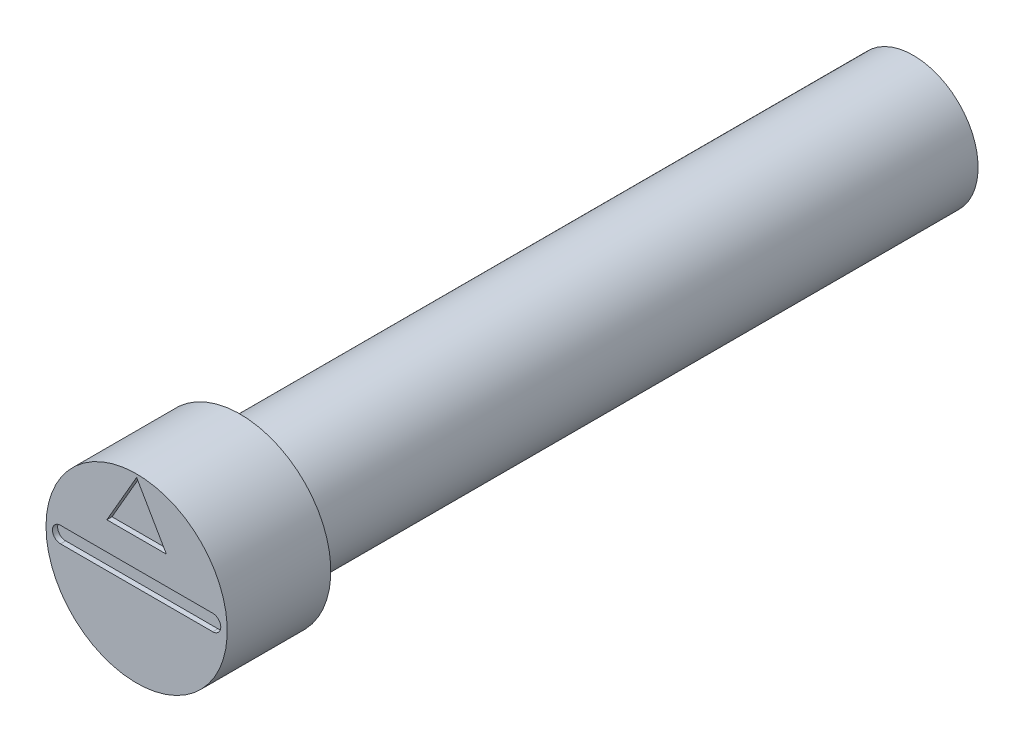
SolidWorks part; units mm, degrees
ref_plane "Front Plane" through (0, 0, 0) normal (0, 0, 1) x (1, 0, 0)
ref_plane "Top Plane" through (0, 0, 0) normal (0, 1, 0) x (1, 0, 0)
ref_plane "Right Plane" through (0, 0, 0) normal (1, 0, 0) x (0, 0, -1)
imported_body "Imported1"
other "DeleteFace1"
sketch "Sketch1" plane through (0, 0, 0) normal (0, 0, 1) x (1, 0, 0)
  line L0 (0, 1.6909) -> (-0.575, 0.695)
  line L1 (-0.575, 0.695) -> (0.575, 0.695)
  line L2 (0.575, 0.695) -> (0, 1.6909)
  line L4 (-1.47, 0.155) -> (1.47, 0.155)
  line L6 (-1.47, -0.155) -> (1.47, -0.155)
  arc A0 (-1.47, 0.155) -> (-1.47, -0.155) centre (-1.47, 0) ccw
  arc A1 (1.47, -0.155) -> (1.47, 0.155) centre (1.47, 0) ccw
  dimension "D6" = 3.25
  dimension "D7" = 1.625
  dimension "D1" = 1.15
  dimension "D2" = 60
  dimension "D3" = 60
  dimension "D4" = 0.31
  dimension "D5" = 0.155
  dimension "D8" = 0.54
extrude "Cut-Extrude1" cut sketch "Sketch1" against normal blind 0.1
